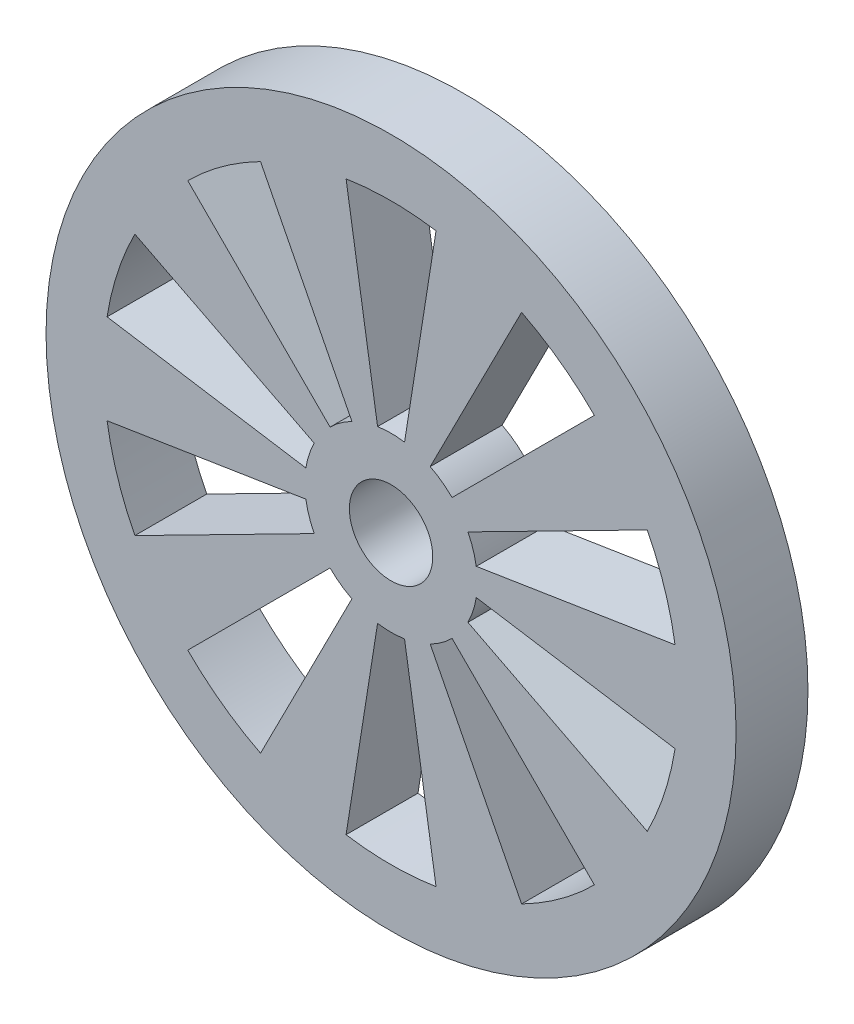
SolidWorks part; units mm, degrees
ref_plane "Alzado" through (0, 0, 0) normal (0, 0, 1) x (1, 0, 0)
ref_plane "Planta" through (0, 0, 0) normal (0, 1, 0) x (1, 0, 0)
ref_plane "Vista lateral" through (0, 0, 0) normal (1, 0, 0) x (0, 0, -1)
sketch "Croquis1" plane through (0, 0, 0) normal (0, 0, 1) x (1, 0, 0)
  circle A0 centre (0, 0) radius 12
  circle A1 centre (0, 0) radius 1.45
  dimension "D1" = 2.9
  dimension "D2" = 24
extrude "Saliente-Extruir1" add sketch "Croquis1" along normal mid plane 2.5
sketch "Croquis2" plane through (0, 0, 1.25) normal (0, 0, 1) x (1, 0, 0)
  line L0 (0, 0) -> (0, -12) construction
  line L1 (-0.4693, -2.9631) -> (-1.5643, -9.8769)
  line L2 (0.4693, -2.9631) -> (1.5643, -9.8769)
  arc A0 (-1.5643, -9.8769) -> (1.5643, -9.8769) centre (0, 0) ccw construction
  arc A1 (-0.4693, -2.9631) -> (0.4693, -2.9631) centre (0, 0) ccw construction
  circle A2 centre (0, 0) radius 12 construction
  arc A3 (-0.4693, -2.9631) -> (0.4693, -2.9631) centre (0, 0) ccw
  arc A4 (-1.5643, -9.8769) -> (1.5643, -9.8769) centre (0, 0) ccw
  dimension "D1" = 6
  dimension "D2" = 20
  dimension "D3" = 18
extrude "Cortar-Extruir1" cut sketch "Croquis2" against normal through all both and the other way through all contours L1 A4 L2 A3
pattern_circular "MatrizC1" count 10 over 360 about axis through (0, 0, 0) along (0, 0, 1) of "Cortar-Extruir1"
